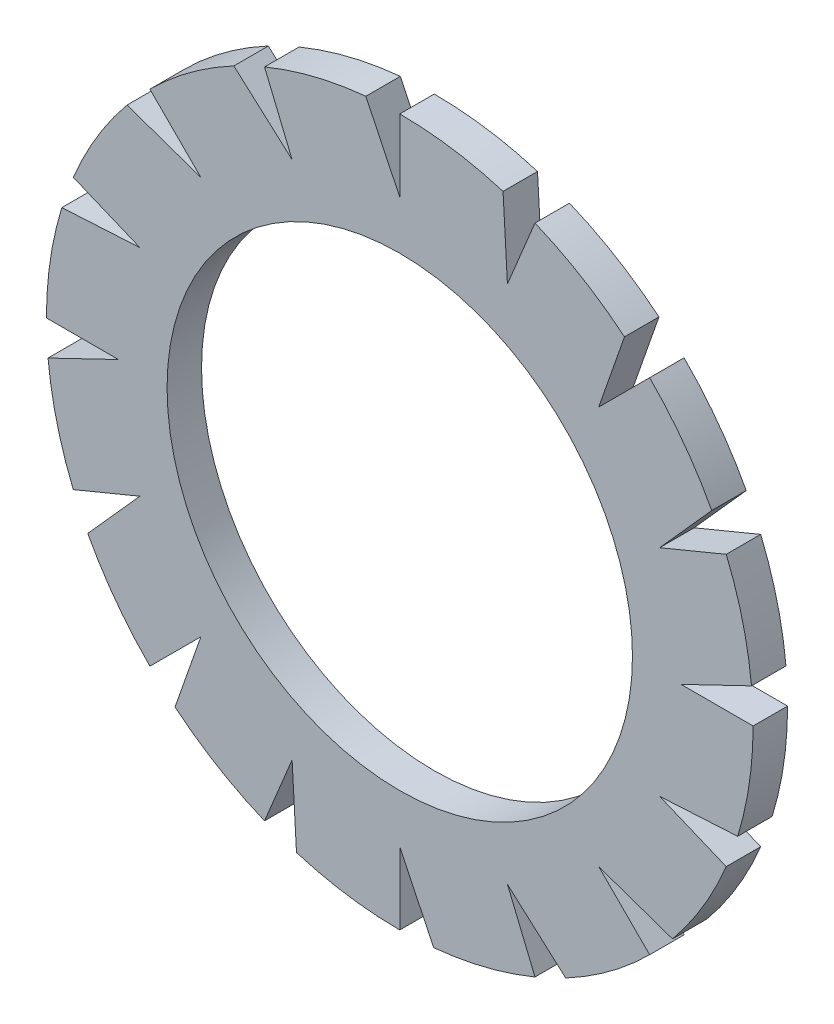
SolidWorks part; units mm, degrees
ref_plane "Front Plane" through (0, 0, 0) normal (0, 0, 1) x (1, 0, 0)
ref_plane "Top Plane" through (0, 0, 0) normal (0, 1, 0) x (1, 0, 0)
ref_plane "Right Plane" through (0, 0, 0) normal (1, 0, 0) x (0, 0, -1)
sketch "BodySke" plane through (0, 0, 0) normal (0, 1, 0) x (1, 0, 0)
  line L0 (0, 0) -> (0, 16) construction
  line L2 (6.75, 0) -> (10.25, 0)
  line L3 (6.75, 0) -> (6.75, 1)
  line L4 (6.75, 1) -> (10.25, 1)
  line L5 (10.25, 0) -> (10.25, 1)
  dimension "Inner_dia" = 13.5
  dimension "Outer_dia" = 20.5
  dimension "Thickness" = 1
  dimension "Num_tooth" = 16
revolve "BaseBody" add sketch "BodySke" angle 360 about L0
sketch "ToothSke" plane through (0, 0, 0) normal (0, 0, 1) x (1, 0, 0)
  line L0 (0, 0) -> (0, 2.7341) construction
  line L1 (0, 8.16) -> (0, 10.25)
  line L2 (-0.7966, 8.121) -> (-1.0063, 10.25) construction
  line L3 (1.0063, 10.25) -> (-1.0063, 10.25) construction
  line L4 (0.7966, 8.121) -> (1.0063, 10.25) construction
  line L5 (0, 8.16) -> (-1.0063, 10.25)
  line L6 (-1.0063, 10.25) -> (0, 10.25)
  circle A0 centre (0, 0) radius 8.16 construction
  arc A1 (-0.7966, 8.121) -> (0.7966, 8.121) centre (0, 0) cw construction
  circle A2 centre (0, 0) radius 6.75 construction
  circle A3 centre (0, 0) radius 6.75 construction
  circle A4 centre (0, 0) radius 10.25 construction
  point P11 (0, 1.083)
  point P12 (0, 8.16)
  point P15 (0, 2.4103)
  point P16 (0, 10.25)
  dimension "D1" = 16.32
  dimension "D2" = 2.0126
  dimension "D3" = 11.25
extrude "ToothCut" cut sketch "ToothSke" against normal through all
pattern_circular "ToothPat" count 16 over 360 about axis through (0, 0, 0) along (0, 0, 1) of "ToothCut"
equation "\"D1@ToothSke\" =  ( \"Inner_dia@BodySke\" + \"Outer_dia@BodySke\" )  * 0.48"
equation "\"D2@ToothSke\" =  pi  * \"Outer_dia@BodySke\" / 2 / \"Num_tooth@BodySke\""
equation "\"D3@ToothSke\" = 360 / 2 / \"Num_tooth@BodySke\" "
equation "\"Num_tooth@ToothPat\" = \"Num_tooth@BodySke\""
